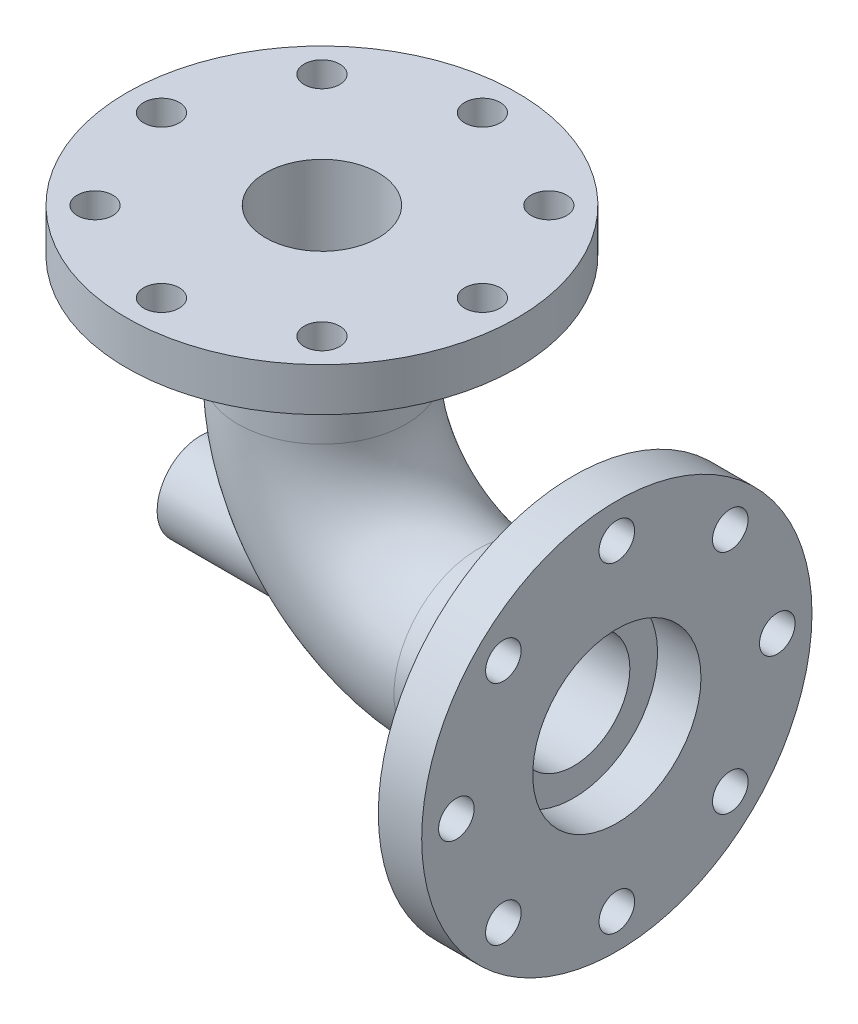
SolidWorks part; units mm, degrees
ref_plane "Front Plane" through (0, 0, 0) normal (0, 0, 1) x (1, 0, 0)
ref_plane "Top Plane" through (0, 0, 0) normal (0, 1, 0) x (1, 0, 0)
ref_plane "Right Plane" through (0, 0, 0) normal (1, 0, 0) x (0, 0, -1)
sketch "Sketch1" plane through (0, 0, 0) normal (0, 0, 1) x (1, 0, 0)
  line L0 (-90, 0) -> (-90, 85)
  line L1 (0, -90) -> (55, -90)
  arc A0 (-90, 0) -> (0, -90) centre (0, 0) ccw
  dimension "D1" = 90
  dimension "D2" = 145
  dimension "D3" = 175
ref_plane "Plane1" through (55, -90, 0) normal (1, 0, 0) x (0, 0, -1)
sketch "Sketch2" plane through (55, -90, 0) normal (1, 0, 0) x (0, 0, -1)
  circle A0 centre (0, 0) radius 48.5
  dimension "D1" = 97
sweep "Sweep-Thin1" add profiles "Sketch2" path "Sketch1" parameters "D1"=16
sketch "Sketch3" plane through (0, 85, 0) normal (0, 1, 0) x (1, 0, 0)
  circle A0 centre (-90, 0) radius 112.5
  circle A1 centre (-90, 0) radius 48.5 construction
  circle A2 centre (-90, 0) radius 48.5
  dimension "D1" = 225
extrude "Extrude1" add sketch "Sketch3" against normal blind 25
sketch "Sketch4" plane through (55, 0, 0) normal (1, 0, 0) x (0, 0, -1)
  circle A0 centre (0, -90) radius 112.5
  circle A1 centre (0, -90) radius 48.5 construction
  circle A2 centre (0, -90) radius 48.5
  dimension "D1" = 225
extrude "Extrude2" add sketch "Sketch4" along normal blind 25
ref_plane "Plane2" through (-160, 0, 0) normal (1, 0, 0) x (0, 0, -1)
sketch "Sketch5" plane through (-160, 0, 0) normal (1, 0, 0) x (0, 0, -1)
  circle A0 centre (0, -90) radius 25
  dimension "D1" = 50
extrude "Extrude3" add sketch "Sketch5" along normal up to next
hole_wizard "CBORE for M16 SBHCS1" positions "Sketch9" profile "Sketch8" counterbore size "M16" standard "Ansi Metric"
sketch "Sketch9" plane through (-160, 0, 0) normal (1, 0, 0) x (0, 0, -1)
  circle A0 centre (0, -90) radius 25 construction
  point P1 (0, -90)
sketch "Sketch8" plane through (-160, -90, 0) normal (0, 1, 0) x (0, 0, 1)
  line L0 (0, 0) -> (0, 76.8961)
  line L1 (0, 76.8961) -> (10, 76.8961)
  line L3 (10, 76.8961) -> (10, 28)
  line L4 (10, 28) -> (12, 28)
  line L5 (12, 28) -> (12, 0)
  line L7 (12, 0) -> (0, 0)
  line L11 (0, -6.35) -> (0, 107.95) construction
  dimension "Thru Hole Dia." = 20
  dimension "Thru Hole Depth" = 76.8961
  dimension "C'Bore Dia." = 24
  dimension "C'Bore Depth" = 28
sketch "Sketch10" plane through (0, 85, 0) normal (0, 1, 0) x (1, 0, 0)
  circle A0 centre (-90, 0) radius 92.5
  dimension "D1" = 185
other "Hole1"
sketch "Sketch11" plane through (0, 85, 0) normal (0, 1, 0) x (-1, 0, 0)
  circle A0 centre (90, -92.5) radius 10.25
  circle A1 centre (90, 0) radius 92.5 construction
  dimension "D1" = 20.5
pattern_circular "CirPattern1" count 8 over 360 about axis through (-90, 0, 0) along (0, 1, 0) of "Hole1"
other "Hole2"
sketch "Sketch13" plane through (80, 0, 0) normal (1, 0, 0) x (0, 0, -1)
  circle A0 centre (0, -182.5) radius 10.25
  circle A1 centre (0, -90) radius 10 construction
  dimension "D1" = 20.5
  dimension "D2" = 92.5
pattern_circular "CirPattern2" count 8 over 360 about axis through (0, -90, 0) along (1, 0, 0) of "Hole2"
